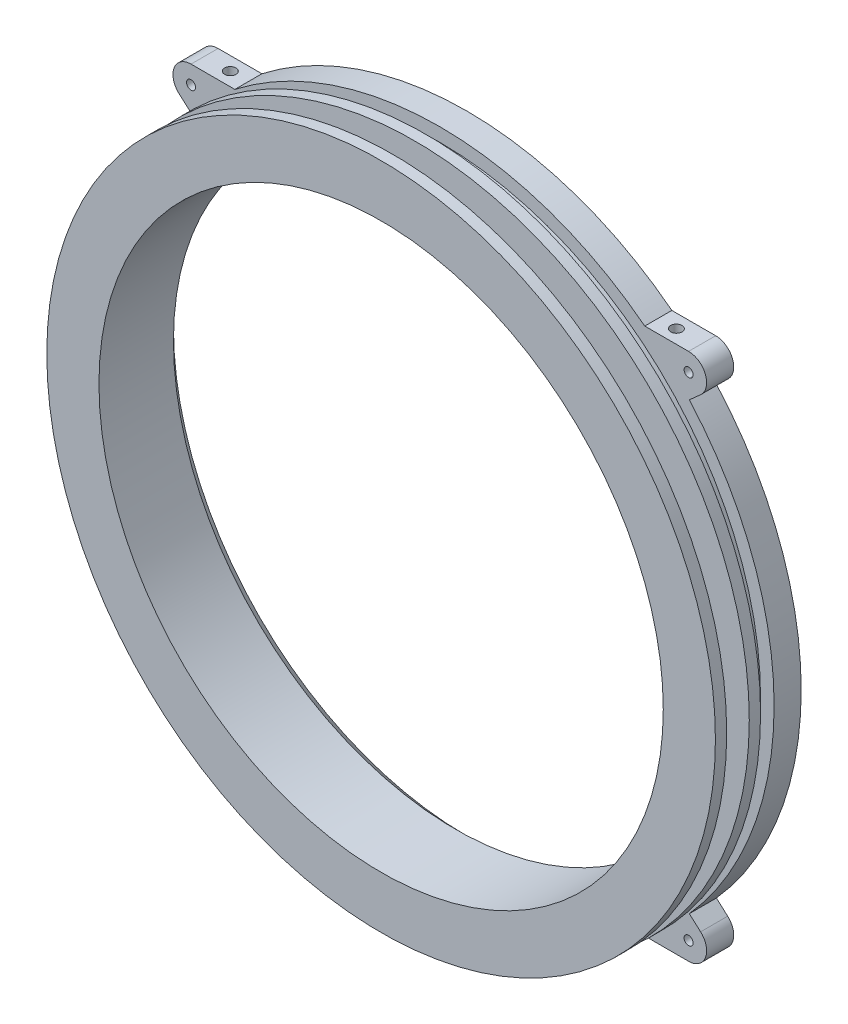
SolidWorks part; units mm, degrees
ref_plane "前视基准面" through (0, 0, 0) normal (0, 0, 1) x (1, 0, 0)
ref_plane "上视基准面" through (0, 0, 0) normal (0, 1, 0) x (1, 0, 0)
ref_plane "右视基准面" through (0, 0, 0) normal (1, 0, 0) x (0, 0, -1)
sketch "草图1" plane through (0, 0, 0) normal (0, 0, 1) x (1, 0, 0)
  circle A0 centre (0, 0) radius 148.1
  circle A1 centre (0, 0) radius 125
  dimension "D1" = 296.2
  dimension "D2" = 250
extrude "凸台-拉伸1" add sketch "草图1" along normal blind 12
sketch "草图2" plane through (0, 0, 12) normal (0, 0, 1) x (1, 0, 0)
  circle A0 centre (0, 0) radius 125
  circle A1 centre (0, 0) radius 142.1
  circle A2 centre (0, 0) radius 125 construction
  circle A3 centre (0, 0) radius 148.1 construction
  dimension "D1" = 6
extrude "凸台-拉伸2" add sketch "草图2" along normal blind 6
sketch "草图3" plane through (0, 0, 18) normal (0, 0, 1) x (1, 0, 0)
  circle A0 centre (0, 0) radius 125
  circle A1 centre (0, 0) radius 148.1
  circle A2 centre (0, 0) radius 125 construction
  circle A3 centre (0, 0) radius 148.1 construction
extrude "凸台-拉伸3" add sketch "草图3" along normal blind 5
sketch "草图4" plane through (0, 0, 23) normal (0, 0, 1) x (1, 0, 0)
  circle A0 centre (0, 0) radius 125
  circle A1 centre (0, 0) radius 133.1
  circle A2 centre (0, 0) radius 148.1 construction
  circle A4 centre (0, 0) radius 125 construction
  dimension "D1" = 15
extrude "凸台-拉伸4" add sketch "草图4" along normal blind 10
sketch "草图5" plane through (0, 0, 33) normal (0, 0, 1) x (1, 0, 0)
  circle A0 centre (0, 0) radius 125
  circle A1 centre (0, 0) radius 148.1
  circle A2 centre (0, 0) radius 125 construction
  circle A3 centre (0, 0) radius 148.1 construction
extrude "凸台-拉伸5" add sketch "草图5" along normal blind 5
sketch "草图6" plane through (0, 0, 0) normal (0, 0, 1) x (1, 0, 0)
  line L0 (-90.7998, 117) -> (-110.2082, 117)
  line L1 (-115.5327, 103.0293) -> (-110.5327, 98.5704)
  line L2 (0, 35.2925) -> (0, -26.8494) construction
  line L3 (-23.0779, 0) -> (26.357, 0) construction
  line L4 (115.5327, 103.0293) -> (110.5327, 98.5704)
  line L5 (90.7998, 117) -> (110.2082, 117)
  line L6 (115.5327, -103.0293) -> (110.5327, -98.5704)
  line L7 (90.7998, -117) -> (110.2082, -117)
  line L8 (-115.5327, -103.0293) -> (-110.5327, -98.5704)
  line L9 (-90.7998, -117) -> (-110.2082, -117)
  circle A0 centre (0, 0) radius 148.1 construction
  arc A1 (-110.2082, 117) -> (-115.5327, 103.0293) centre (-110.2082, 109) ccw
  arc A2 (-110.5327, 98.5704) -> (-90.7998, 117) centre (0, 0) cw
  circle A3 centre (-110.2082, 109) radius 2
  circle A4 centre (110.2082, 109) radius 2
  arc A5 (110.5327, 98.5704) -> (90.7998, 117) centre (0, 0) ccw
  arc A6 (110.2082, 117) -> (115.5327, 103.0293) centre (110.2082, 109) cw
  circle A7 centre (110.2082, -109) radius 2
  arc A8 (110.2082, -117) -> (115.5327, -103.0293) centre (110.2082, -109) ccw
  arc A9 (110.5327, -98.5704) -> (90.7998, -117) centre (0, 0) cw
  circle A10 centre (-110.2082, -109) radius 2
  arc A11 (-110.5327, -98.5704) -> (-90.7998, -117) centre (0, 0) ccw
  arc A12 (-110.2082, -117) -> (-115.5327, -103.0293) centre (-110.2082, -109) cw
  dimension "D1" = 4
  dimension "D2" = 8
  dimension "D3" = 5
  dimension "D4" = 117
extrude "凸台-拉伸6" add sketch "草图6" along normal blind 12
sketch "草图7" plane through (0, 117, 0) normal (0, 1, 0) x (1, 0, 0)
  line L0 (-90.7998, 0) -> (-110.2082, 0) construction
  line L2 (-90.7998, -12) -> (-90.7998, 0) construction
  circle A0 centre (-98.7998, -6) radius 2.5
  dimension "D1" = 5
  dimension "D2" = 6
  dimension "D3" = 8
extrude "切除-拉伸1" cut sketch "草图7" against normal blind 15
mirror "镜向1" about plane through (0, 0, 0) normal (1, 0, 0) of "切除-拉伸1"
mirror "镜向2" about plane through (0, 0, 0) normal (0, 1, 0) of "镜向1", "切除-拉伸1"
chamfer "倒角1" distance 5 angle 45 1 edges at (125, 0, 0)
